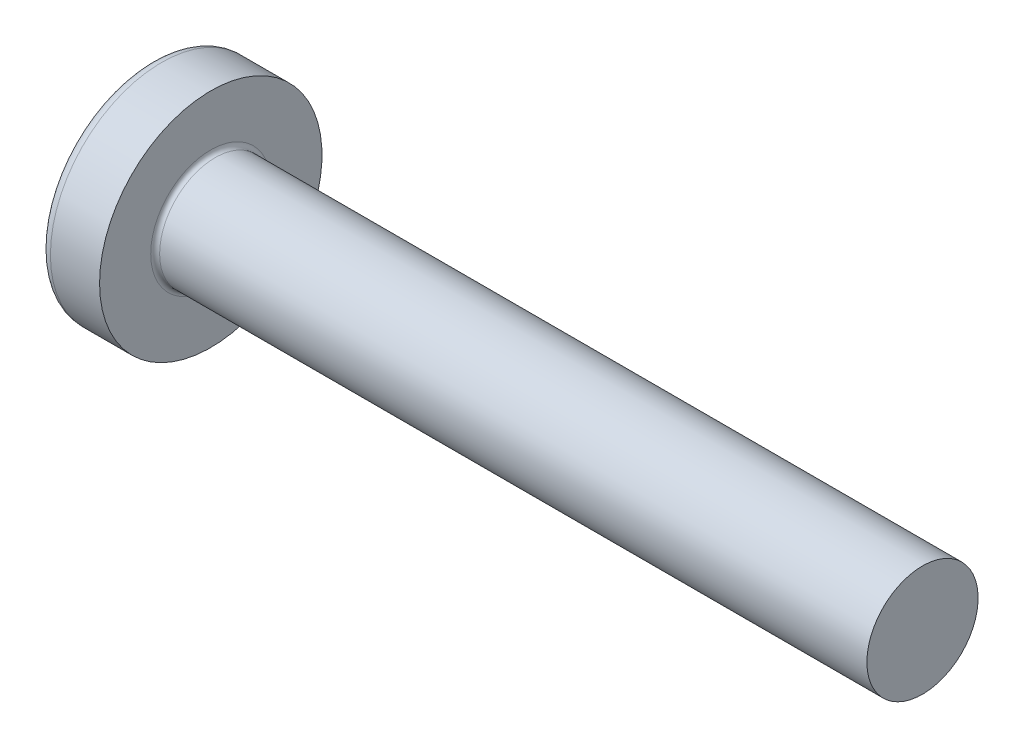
SolidWorks part; units mm, degrees
ref_plane "Plane1" through (0, 0, 0) normal (0, 0, 1) x (1, 0, 0)
ref_plane "Plane2" through (0, 0, 0) normal (0, 1, 0) x (1, 0, 0)
ref_plane "Plane3" through (0, 0, 0) normal (1, 0, 0) x (0, 0, -1)
sketch "BodySke" plane through (0, 0, 0) normal (0, 0, 1) x (1, 0, 0)
  line L0 (2.1, 1.25) -> (2.1, 2.5)
  line L1 (2.325, 6.35) -> (2.325, -3.175) construction
  line L2 (-25.4, 0) -> (127, 0) construction
  line L3 (18.1, 0) -> (0, 0)
  line L4 (2.1, 1.25) -> (18.1, 1.25)
  line L5 (18.1, 1.25) -> (18.1, 0)
  line L6 (0.995, 2.5) -> (2.1, 2.5)
  line L8 (2.1, 6.35) -> (2.1, -3.175) construction
  arc A0 (0.8032, 2.4043) -> (0, 0) centre (4, 0) ccw
  arc A2 (0.8032, 2.4043) -> (0.995, 2.5) centre (0.995, 2.26) cw
revolve "Base-Revolve" add sketch "BodySke"
fillet "Fillet1" radius 0.1 1 edges at (2.1, 0, 1.25)
sketch "Sketch3" plane through (0, 0, 0) normal (1, 0, 0) x (0, 0, -1)
  line L0 (0.37, -1.3) -> (-0.37, -1.3)
  line L1 (0.37, -1.3) -> (0.37, 1.3)
  line L2 (-0.37, 1.3) -> (0.37, 1.3)
  line L3 (-0.37, 1.3) -> (-0.37, -1.3)
ref_plane "Plane4" through (1.5, 0, 0) normal (1, 0, 0) x (0, 0, -1)
sketch "Sketch4" plane through (1.5, 0, 0) normal (1, 0, 0) x (0, 0, -1)
  line L0 (0.37, -0.5521) -> (-0.37, -0.5521)
  line L1 (0.37, -0.5521) -> (0.37, 0.5521)
  line L2 (-0.37, 0.5521) -> (0.37, 0.5521)
  line L3 (-0.37, 0.5521) -> (-0.37, -0.5521)
loft "Recess" cut profiles "Sketch3", "Sketch4"
pattern_circular "RecPat" count 2 every 90 about axis through (0, 0, 0) along (1, 0, 0) of "Recess"
sketch "RecCorSke" plane through (0, 0, 0) normal (0, 0, 1) x (1, 0, 0)
  line L0 (-3.175, 0) -> (15.875, 0) construction
  line L1 (-25.4, 0) -> (127, 0) construction
  line L2 (0, 0) -> (0, 0.6609)
  line L3 (0, 0.6609) -> (1.5, 0.556)
  line L4 (1.5, 0.556) -> (1.6807, 0)
  line L5 (1.6807, 0) -> (0, 0)
revolve "RecessCore" cut sketch "RecCorSke" angle 360 about L0
sketch "ThdSchSke" plane through (0, 0, 0) normal (0, 0, 1) x (1, 0, 0)
  line L0 (3, -0.9965) -> (2.8225, -1.25)
  line L1 (3, -0.9965) -> (3.1775, -1.25)
  line L2 (3.1775, -1.25) -> (3.1775, -1.5625)
  line L3 (-3.175, 0) -> (5.1513, 0) construction
  line L5 (3.1775, -1.5625) -> (2.8225, -1.5625)
  line L6 (2.8225, -1.5625) -> (2.8225, -1.25)
revolve "ThreadSchematic" [suppressed] cut sketch "ThdSchSke" angle 360 about L3
pattern_linear "ThdSchPat" [suppressed]
equation "\"D1@Sketch3\" = \"Cross_dia@Sketch3\" / 2"
equation "\"D2@Sketch3\" = \"Cross_width@Sketch3\" / 2"
equation "\"Depth@RecCorSke\" = \"Cross_depth@Plane4\""
equation "\"D1@Sketch4\" = \"Cross_width@Sketch3\""
equation "\"D2@Sketch4\" = \"Cross_dia@Sketch3\" - 2.0 * \"Cross_depth@Plane4\" * tan(26.5  * 0.017453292)"
equation "\"D3@Sketch4\" = \"D1@Sketch4\" / 2"
equation "\"D4@Sketch4\" = \"D2@Sketch4\" / 2"
equation "\"Thread_length@ThreadCosmetic\" = ((sgn( (\"Length@BodySke\" - \"Advance@BodySke\" * 2.0 ) - \"Thread_nom@BodySke\" )-1)*( (\"Length@BodySke\" - \"Advance@BodySke\" * 2.0 ) - \"Thread_nom@BodySke\" ))/-2+ \"Thread_"
equation "\"Thread_minor@ThdSchSke\" = \"Thread_minor@ThreadCosmetic\""
equation "\"Diameter@ThdSchSke\" = \"Diameter@BodySke\""
equation "\"Overcut@ThdSchSke\" = \"Diameter@BodySke\" * 1.25"
equation "\"Start@ThdSchSke\" = \"Head_ht@BodySke\" + \"Length@BodySke\" - \"Thread_length@ThreadCosmetic\"  '---Non-countersunk---"
equation "\"Num_threads@ThdSchPat\" = int( \"Thread_length@ThreadCosmetic\" / \"Advance@BodySke\" + 0.999 )  + 1"
equation "\"Advance@ThdSchPat\" = \"Thread_length@ThreadCosmetic\" /  (\"Num_threads@ThdSchPat\" - 1) 'relax it"
